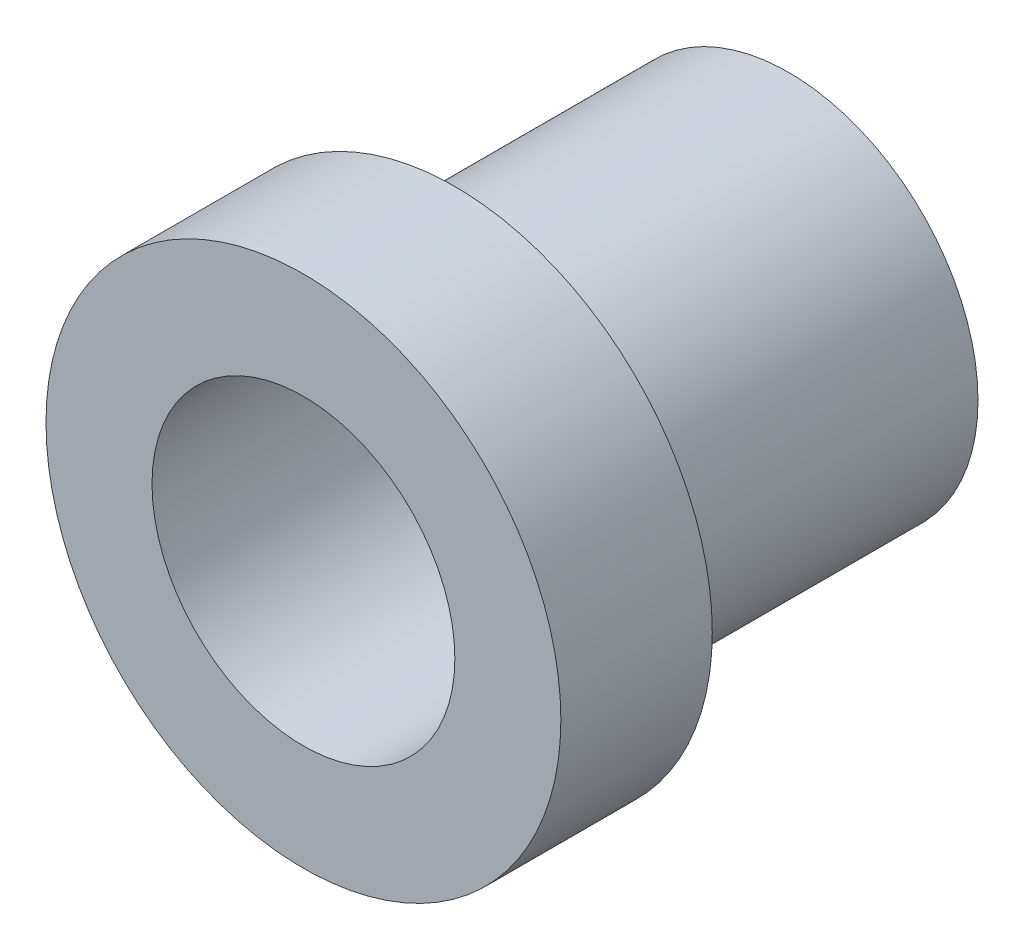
SolidWorks part; units mm, degrees
ref_plane "Front Plane" through (0, 0, 0) normal (0, 0, 1) x (1, 0, 0)
ref_plane "Top Plane" through (0, 0, 0) normal (0, 1, 0) x (1, 0, 0)
ref_plane "Right Plane" through (0, 0, 0) normal (1, 0, 0) x (0, 0, -1)
sketch "Sketch1" plane through (0, 0, 0) normal (0, 0, 1) x (1, 0, 0)
  circle A0 centre (0, 0) radius 5.3975
  circle A1 centre (0, 0) radius 3.175
  dimension "D1" = 10.795
  dimension "D2" = 6.35
extrude "Boss-Extrude1" add sketch "Sketch1" along normal blind 3.175
sketch "Sketch2" plane through (0, 0, 0) normal (0, 0, -1) x (-1, 0, 0)
  circle A0 centre (0, 0) radius 3.175
  circle A1 centre (0, 0) radius 3.9688
  dimension "D1" = 6.35
  dimension "D2" = 7.9375
extrude "Boss-Extrude2" add sketch "Sketch2" along normal blind 7
